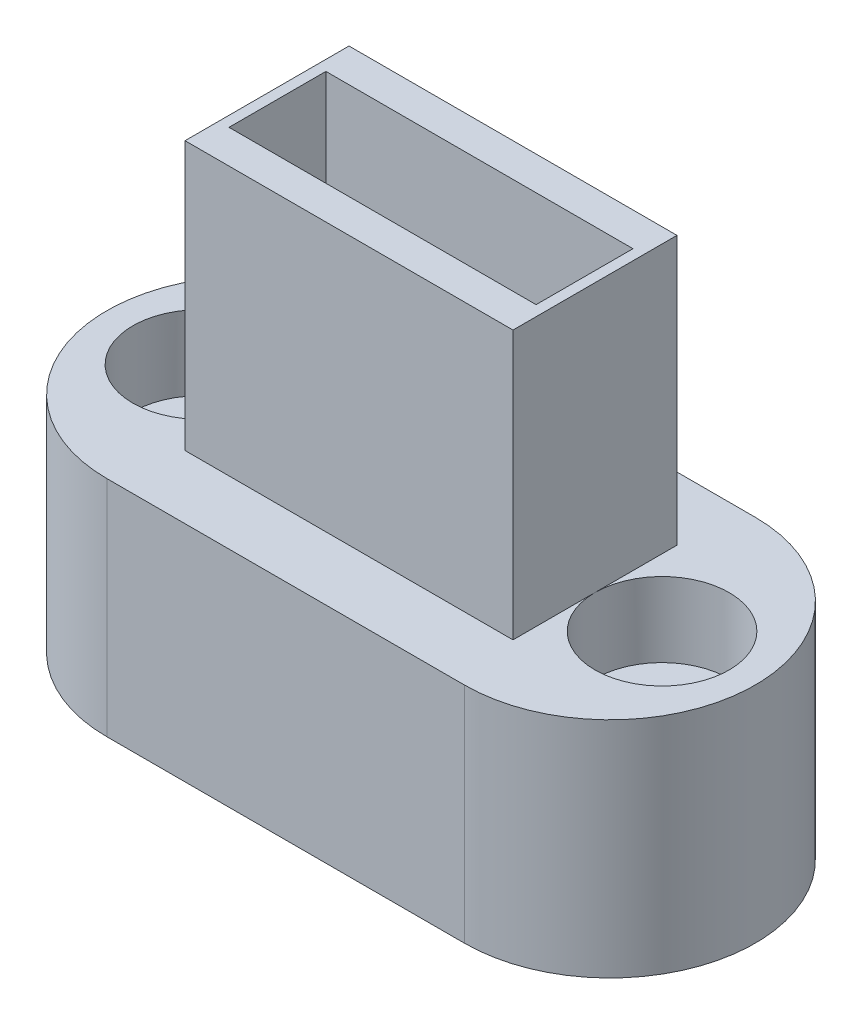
SolidWorks part; units mm, degrees
ref_plane "Plan de face" through (0, 0, 0) normal (0, 0, 1) x (1, 0, 0)
ref_plane "Plan de dessus" through (0, 0, 0) normal (0, 1, 0) x (1, 0, 0)
ref_plane "Plan de droite" through (0, 0, 0) normal (1, 0, 0) x (0, 0, -1)
sketch "Esquisse2" plane through (0, 0, 0) normal (0, 1, 0) x (1, 0, 0)
  line L0 (-53.9537, 0) -> (-29.9537, 0) construction
  line L1 (-53.9537, 9.75) -> (-29.9537, 9.75)
  line L2 (-53.9537, -9.75) -> (-29.9537, -9.75)
  arc A0 (-53.9537, 9.75) -> (-53.9537, -9.75) centre (-53.9537, 0) ccw
  arc A1 (-29.9537, -9.75) -> (-29.9537, 9.75) centre (-29.9537, 0) ccw
  point P3 (-41.9537, 0)
  dimension "D1" = 19.5
  dimension "D2" = 24
extrude "Boss.-Extru.1" add sketch "Esquisse2" along normal blind 15
sketch "Esquisse3" plane through (0, 15, 0) normal (0, 1, 0) x (1, 0, 0)
  line L0 (-53.9537, -9.75) -> (-29.9537, -9.75) construction
  line L1 (-52.9537, -5.5) -> (-30.9537, -5.5)
  line L2 (-52.9537, -5.5) -> (-52.9537, 5.5)
  line L3 (-52.9537, 5.5) -> (-30.9537, 5.5)
  line L4 (-30.9537, -5.5) -> (-30.9537, 5.5)
  line L5 (-29.9537, 9.75) -> (-53.9537, 9.75) construction
  arc A0 (-53.9537, 9.75) -> (-53.9537, -9.75) centre (-53.9537, 0) ccw construction
  arc A1 (-29.9537, -9.75) -> (-29.9537, 9.75) centre (-29.9537, 0) ccw construction
  point P8 (-63.7037, 0)
  point P12 (-20.2037, 0)
  dimension "D1" = 11
  dimension "D2" = 4.25
  dimension "D3" = 4.25
  dimension "D4" = 22
  dimension "D5" = 10.75
  dimension "D6" = 10.75
extrude "Boss.-Extru.2" add sketch "Esquisse3" along normal blind 18
sketch "Esquisse4" plane through (0, 33, 0) normal (0, 1, 0) x (1, 0, 0)
  line L0 (-52.9537, 5.5) -> (-52.9537, -5.5) construction
  line L1 (-52.0537, -3.25) -> (-31.8537, -3.25)
  line L2 (-52.0537, -3.25) -> (-52.0537, 3.25)
  line L3 (-52.0537, 3.25) -> (-31.8537, 3.25)
  line L4 (-31.8537, -3.25) -> (-31.8537, 3.25)
  line L5 (-30.9537, -5.5) -> (-30.9537, 5.5) construction
  line L6 (-30.9537, 5.5) -> (-52.9537, 5.5) construction
  line L7 (-52.9537, -5.5) -> (-30.9537, -5.5) construction
  dimension "D1" = 20.2
  dimension "D2" = 0.9
  dimension "D3" = 0.9
  dimension "D4" = 6.5
  dimension "D5" = 2.25
  dimension "D6" = 2.25
extrude "Enlèv. mat.-Extru.1" cut sketch "Esquisse4" against normal blind 6
sketch "Esquisse5" plane through (0, 27, 0) normal (0, 1, 0) x (1, 0, 0)
  line L0 (-31.8537, -3.25) -> (-31.8537, 3.25) construction
  line L1 (-52.0537, 1.5) -> (-31.8537, 1.5)
  line L2 (-52.0537, 1.5) -> (-52.0537, -1.5)
  line L3 (-52.0537, -1.5) -> (-31.8537, -1.5)
  line L4 (-31.8537, 1.5) -> (-31.8537, -1.5)
  line L5 (-52.0537, 3.25) -> (-52.0537, -3.25) construction
  line L6 (-31.8537, 3.25) -> (-52.0537, 3.25) construction
  line L7 (-52.0537, -3.25) -> (-31.8537, -3.25) construction
  point P4 (-31.8537, 0)
  dimension "D1" = 0
  dimension "D2" = 0
  dimension "D3" = 1.75
  dimension "D4" = 3
  dimension "D5" = 1.75
extrude "Enlèv. mat.-Extru.2" cut sketch "Esquisse5" against normal through all
sketch "Esquisse6" plane through (0, 0, 0) normal (0, -1, 0) x (1, 0, 0)
  line L0 (-29.9537, -9.75) -> (-53.9537, -9.75) construction
  line L1 (-31.8537, -1.5) -> (-52.0537, -1.5)
  line L2 (-31.8537, -1.5) -> (-31.8537, -9.75)
  line L3 (-31.8537, -9.75) -> (-52.0537, -9.75)
  line L4 (-52.0537, -1.5) -> (-52.0537, -9.75)
  line L5 (-52.0537, -1.5) -> (-52.0537, 1.5) construction
  dimension "D1" = 0
extrude "Enlèv. mat.-Extru.3" cut sketch "Esquisse6" against normal blind 3
sketch "Esquisse7" plane through (0, 15, 0) normal (0, 1, 0) x (1, 0, 0)
  line L0 (-30.9537, -5.5) -> (-30.9537, 5.5) construction
  circle A0 centre (-26.4537, 0) radius 4.5
  arc A1 (-29.9537, -9.75) -> (-29.9537, 9.75) centre (-29.9537, 0) ccw construction
  dimension "D1" = 0
  dimension "D2" = 4.5
extrude "Enlèv. mat.-Extru.4" cut sketch "Esquisse7" against normal blind 5
sketch "Esquisse8" plane through (0, 15, 0) normal (0, 1, 0) x (1, 0, 0)
  line L0 (-52.9537, 5.5) -> (-52.9537, -5.5) construction
  circle A0 centre (-57.4537, 0) radius 4.5
  arc A1 (-53.9537, 9.75) -> (-53.9537, -9.75) centre (-53.9537, 0) ccw construction
  point P2 (-63.7037, 0)
  dimension "D1" = 0
  dimension "D2" = 4.5
extrude "Enlèv. mat.-Extru.5" cut sketch "Esquisse8" against normal blind 5
sketch "Esquisse9" plane through (0, 10, 0) normal (0, 1, 0) x (1, 0, 0)
  circle A0 centre (-26.4537, 0) radius 2.25
extrude "Enlèv. mat.-Extru.6" cut sketch "Esquisse9" against normal through all
sketch "Esquisse10" plane through (0, 10, 0) normal (0, 1, 0) x (1, 0, 0)
  circle A0 centre (-57.4537, 0) radius 2.25
extrude "Enlèv. mat.-Extru.8" cut sketch "Esquisse10" against normal through all
sketch "Esquisse11" plane through (0, 33, 0) normal (0, 1, 0) x (1, 0, 0)
  line L0 (-30.9537, -5.5) -> (-30.9537, 5.5) construction
  line L1 (-31.6537, -3.25) -> (-52.2537, -3.25)
  line L2 (-31.6537, -3.25) -> (-31.6537, 3.25)
  line L3 (-31.6537, 3.25) -> (-52.2537, 3.25)
  line L4 (-52.2537, -3.25) -> (-52.2537, 3.25)
  line L5 (-52.9537, 5.5) -> (-52.9537, -5.5) construction
  line L6 (-31.8537, 3.25) -> (-52.0537, 3.25) construction
  line L7 (-52.0537, -3.25) -> (-31.8537, -3.25) construction
  point P4 (-30.9537, 0)
  dimension "D1" = 20.6
  dimension "D2" = 0.7
  dimension "D3" = 0.7
  dimension "D4" = 0
  dimension "D5" = 0
extrude "Enlèv. mat.-Extru.9" cut sketch "Esquisse11" against normal blind 7
